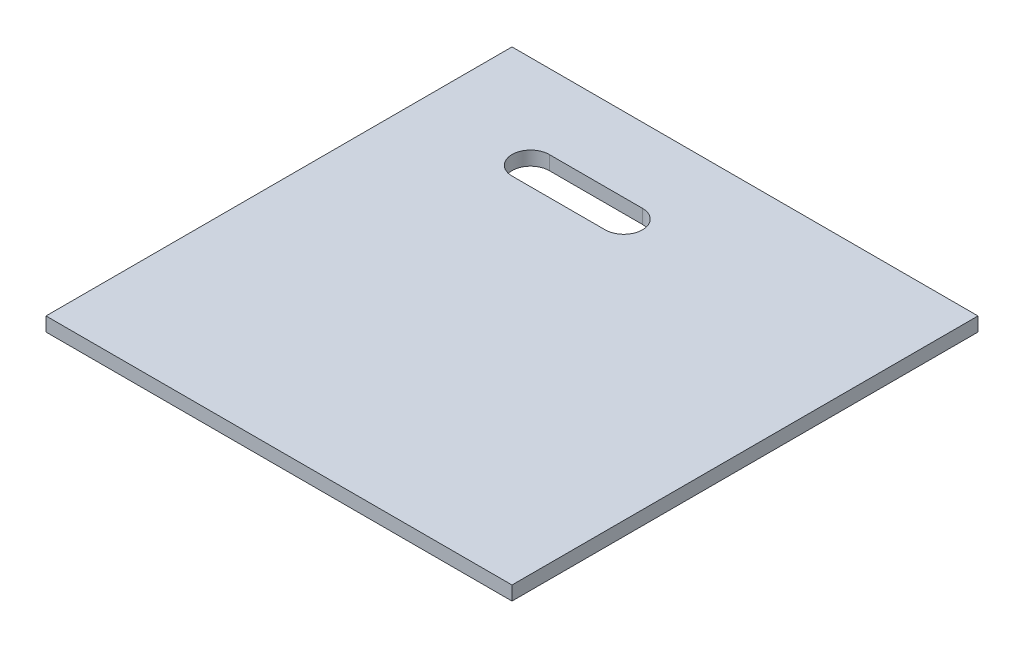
SolidWorks part; units mm, degrees
ref_plane "Front Plane" through (0, 0, 0) normal (0, 0, 1) x (1, 0, 0)
ref_plane "Top Plane" through (0, 0, 0) normal (0, 1, 0) x (1, 0, 0)
ref_plane "Right Plane" through (0, 0, 0) normal (1, 0, 0) x (0, 0, -1)
sketch "Sketch1" plane through (0, 0, 0) normal (0, 1, 0) x (1, 0, 0)
  line L1 (-250, -250) -> (250, -250)
  line L2 (-250, -250) -> (-250, 250)
  line L3 (-250, 250) -> (250, 250)
  line L4 (250, -250) -> (250, 250)
  line L5 (-250, -250) -> (250, 250) construction
  line L6 (-250, 250) -> (250, -250) construction
  point P0 (0, 0)
  dimension "D1" = 500
  dimension "D2" = 500
extrude "Extrude1" add sketch "Sketch1" along normal blind 15
sketch "Sketch2" plane through (0, 15, 0) normal (0, 1, 0) x (1, 0, 0)
  line L0 (-130, 150) -> (-30, 150) construction
  line L1 (-130, 130) -> (-30, 130)
  line L2 (-130, 170) -> (-30, 170)
  line L5 (-250, 250) -> (-250, -250) construction
  line L6 (250, 250) -> (-250, 250) construction
  arc A0 (-130, 130) -> (-130, 170) centre (-130, 150) cw
  arc A1 (-30, 130) -> (-30, 170) centre (-30, 150) ccw
  dimension "D1" = 20
  dimension "D2" = 100
  dimension "D3" = 120
  dimension "D4" = 100
extrude "Extrude2" cut sketch "Sketch2" against normal blind 15
